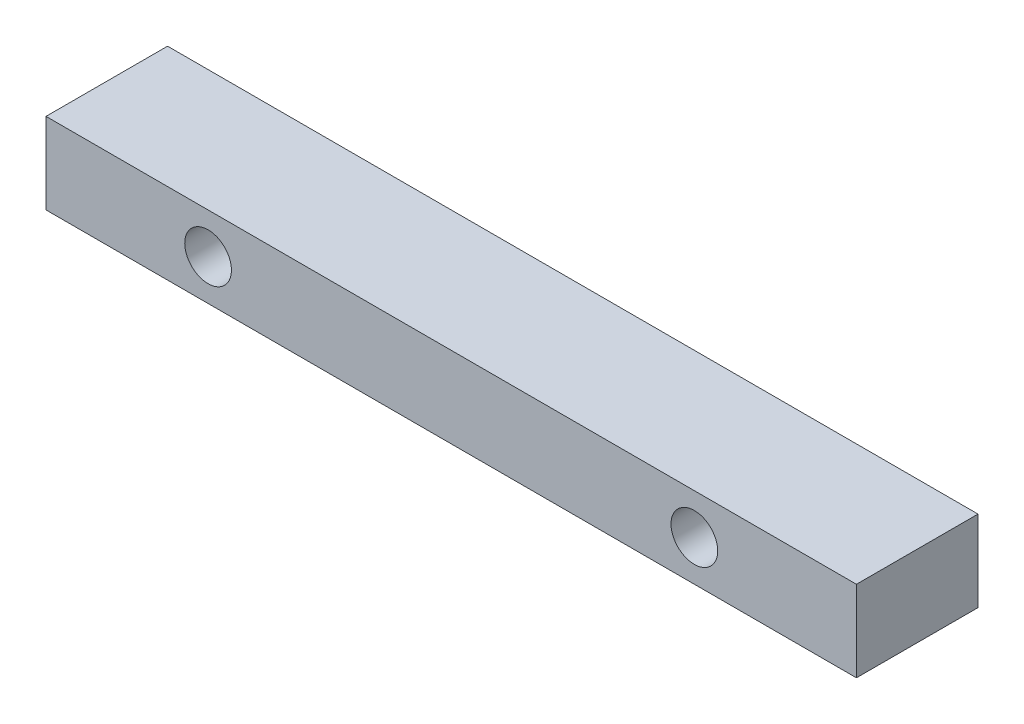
SolidWorks part; units mm, degrees
ref_plane "Front Plane" through (0, 0, 0) normal (0, 0, 1) x (1, 0, 0)
ref_plane "Top Plane" through (0, 0, 0) normal (0, 1, 0) x (1, 0, 0)
ref_plane "Right Plane" through (0, 0, 0) normal (1, 0, 0) x (0, 0, -1)
sketch "Sketch1" plane through (0, 0, 0) normal (0, 0, 1) x (1, 0, 0)
  line L0 (-31.75, 6.35) -> (-31.75, 0) construction
  line L1 (0, 0) -> (-63.5, 0)
  line L2 (0, 0) -> (0, 6.35)
  line L3 (0, 6.35) -> (-63.5, 6.35)
  line L4 (-63.5, 0) -> (-63.5, 6.35)
  circle A0 centre (-50.8, 3.175) radius 1.8288
  circle A2 centre (-12.7, 3.175) radius 1.8288
  point P11 (0, 0)
  point P12 (-63.5, 3.175)
  dimension "D3" = 3.6576
  dimension "D1" = 63.5
  dimension "D2" = 6.35
  dimension "D4" = 12.7
extrude "Boss-Extrude1" add sketch "Sketch1" along normal blind 9.525
